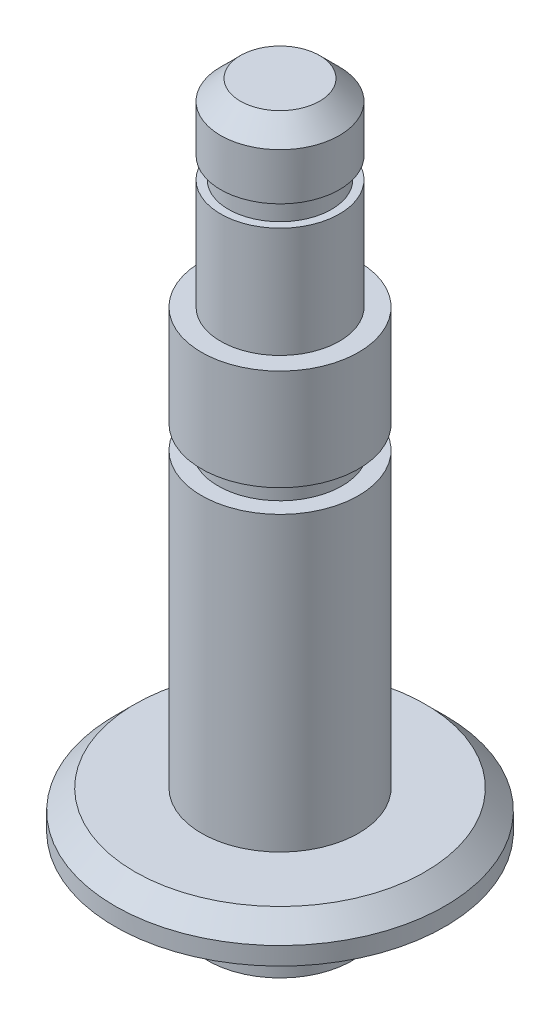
SolidWorks part; units mm, degrees
ref_plane "Front Plane" through (0, 0, 0) normal (0, 0, 1) x (1, 0, 0)
ref_plane "Top Plane" through (0, 0, 0) normal (0, 1, 0) x (1, 0, 0)
ref_plane "Right Plane" through (0, 0, 0) normal (1, 0, 0) x (0, 0, -1)
sketch "Sketch2" plane through (0, 0, 0) normal (1, 0, 0) x (0, 0, -1)
  line L0 (0, 0) -> (0, 86.5522) construction
  line L1 (2.7781, 0) -> (6.35, 0)
  line L2 (2.7781, 0) -> (2.7781, -2.921)
  line L3 (6.35, 0) -> (6.35, 1.4478)
  line L4 (6.35, 1.4478) -> (3.0226, 1.4478)
  line L5 (3.0226, 1.4478) -> (3.0226, 17.4752)
  line L6 (3.0226, 17.4752) -> (2.286, 17.4752)
  line L7 (0, 25.0952) -> (0, -2.921)
  line L8 (0, -2.921) -> (2.7781, -2.921)
  line L9 (2.286, 17.4752) -> (2.286, 25.0952)
  line L10 (2.286, 25.0952) -> (0, 25.0952)
  dimension "D1" = 6.0452
  dimension "D2" = 1.4478
  dimension "D3" = 17.4752
  dimension "D4" = 12.7
  dimension "D5" = 5.5562
  dimension "D6" = 2.921
  dimension "D7" = 25.0952
  dimension "D8" = 4.572
revolve "Revolve1" add sketch "Sketch2" angle 360 about L0
chamfer "Chamfer2" distance 0.762 angle 45 1 edges at (0, 1.4478, -6.35)
sketch "Sketch3" plane through (0, 0, 0) normal (1, 0, 0) x (0, 0, -1)
  line L0 (3.0226, 1.4478) -> (3.0226, 17.4752) construction
  line L1 (3.0226, 13.589) -> (2.3813, 13.589)
  line L2 (3.0226, 13.589) -> (3.0226, 12.7)
  line L3 (3.0226, 12.7) -> (2.3813, 12.7)
  line L4 (2.3813, 13.589) -> (2.3813, 12.7)
  line L5 (0, 0) -> (0, 16.4794) construction
  line L6 (-6.35, 0) -> (6.35, 0) construction
  dimension "D1" = 4.7625
  dimension "D2" = 0.889
  dimension "D3" = 12.7
revolve "Cut-Revolve1" cut sketch "Sketch3" angle 360 about L5
chamfer "Chamfer3" distance 0.762 angle 45 1 edges at (0, 25.0952, -2.286)
sketch "Sketch4" plane through (0, 0, 0) normal (1, 0, 0) x (0, 0, -1)
  line L0 (2.286, 17.4752) -> (2.286, 24.3332) construction
  line L1 (2.286, 22.5269) -> (1.9812, 22.5269)
  line L2 (2.286, 22.5269) -> (2.286, 21.717)
  line L3 (2.286, 21.717) -> (1.9812, 21.717)
  line L4 (1.9812, 22.5269) -> (1.9812, 21.717)
  line L5 (0, 0) -> (0, 26.2538) construction
  line L6 (-6.35, 0) -> (6.35, 0) construction
  dimension "D1" = 3.9624
  dimension "D2" = 0.8099
  dimension "D3" = 21.717
revolve "Cut-Revolve2" cut sketch "Sketch4" angle 360 about L5
